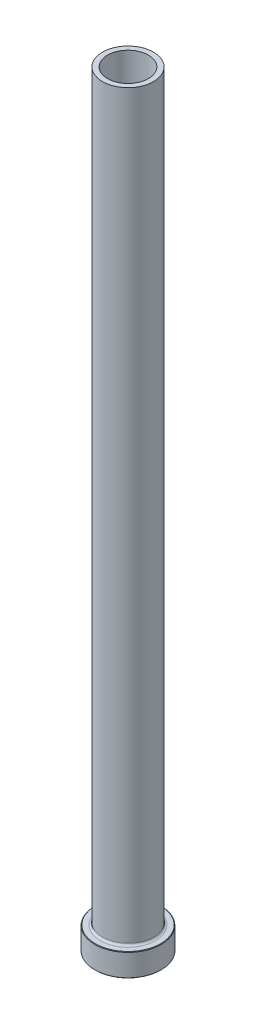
SolidWorks part; units mm, degrees
ref_plane "Front Plane" through (0, 0, 0) normal (0, 0, 1) x (1, 0, 0)
ref_plane "Top Plane" through (0, 0, 0) normal (0, 1, 0) x (1, 0, 0)
ref_plane "Right Plane" through (0, 0, 0) normal (1, 0, 0) x (0, 0, -1)
sketch "Sketch1" plane through (0, 0, 0) normal (0, 0, 1) x (1, 0, 0)
  line L0 (-8, 300) -> (-10, 300)
  line L1 (-10, 300) -> (-10, 9)
  line L2 (-10, 9) -> (-13, 9)
  line L3 (-13, 9) -> (-13, 0)
  line L4 (14.3, 0) -> (-14.3, 0) construction
  line L5 (-13, 0) -> (-8.25, 0)
  line L6 (-8, 245) -> (-8, 300)
  line L7 (0, 92.1877) -> (0, -15.5353) construction
  line L8 (0, -14.3) -> (0, 14.3) construction
  line L9 (-8, 245) -> (-8.25, 233)
  line L10 (-8.25, 233) -> (-8.25, 0)
  dimension "D1" = 0.25
  dimension "ID" = 16
  dimension "OD" = 20
  dimension "L" = 300
  dimension "H" = 26
  dimension "T" = 9
  dimension "N" = 55
  dimension "D2" = 12
revolve "Revolve1" add sketch "Sketch1" angle 360 about L7
fillet "Fillet1" radius 0.8 1 edges at (0, 9, 10)
chamfer "Chamfer1" distance 0.2 angle 45 2 edges at (0, 9, 13) (0, 0, 13)
chamfer "Chamfer3" distance 0.5 angle 45 1 edges at (0, 0, 8.25)
